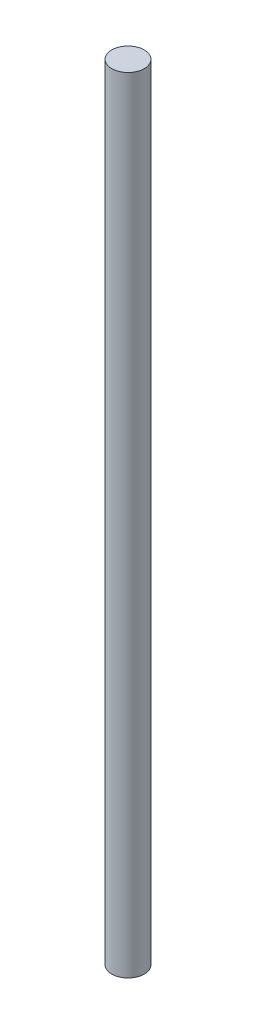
SolidWorks part; units mm, degrees
ref_plane "Front" through (0, 0, 0) normal (0, 0, 1) x (1, 0, 0)
ref_plane "Top" through (0, 0, 0) normal (0, 1, 0) x (1, 0, 0)
ref_plane "Right" through (0, 0, 0) normal (1, 0, 0) x (0, 0, -1)
sketch "Sketch1" plane through (0, 0, 0) normal (0, 1, 0) x (1, 0, 0)
  circle A0 centre (0, 0) radius 1.5773
  dimension "D1" = 3.1547
extrude "Boss-Extrude1" add sketch "Sketch1" along normal blind 76.2
